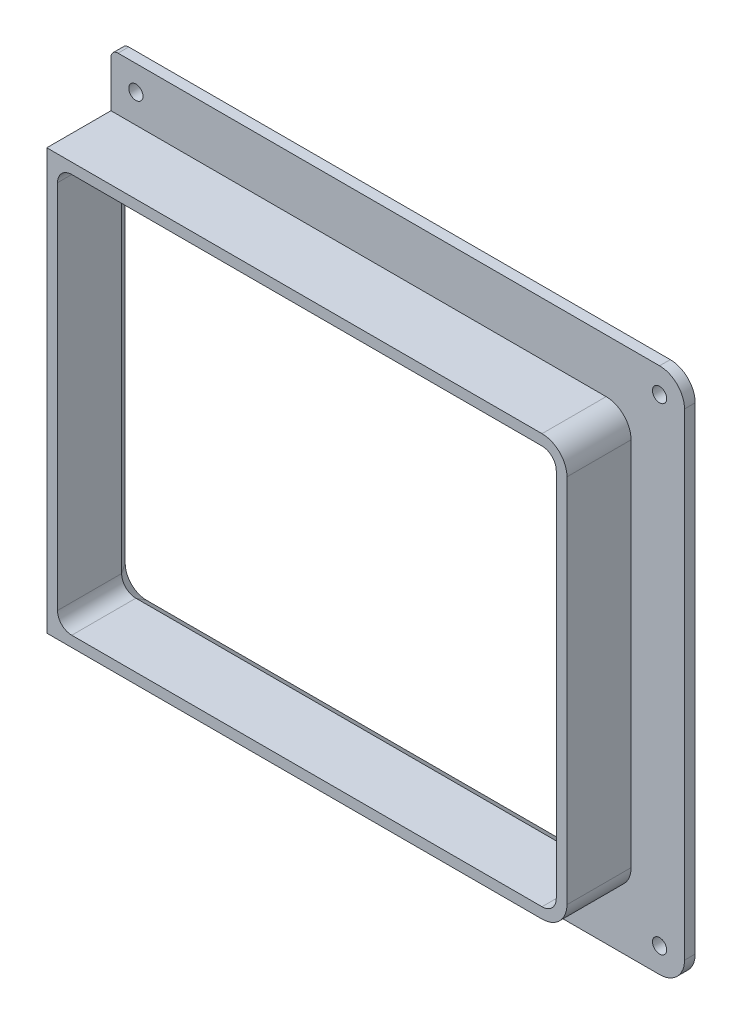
SolidWorks part; units mm, degrees
ref_plane "Спереди" through (0, 0, 0) normal (0, 0, 1) x (1, 0, 0)
ref_plane "Сверху" through (0, 0, 0) normal (0, 1, 0) x (1, 0, 0)
ref_plane "Справа" through (0, 0, 0) normal (1, 0, 0) x (0, 0, -1)
sketch "Эскиз1" plane through (0, 0, 0) normal (1, 0, 0) x (0, 0, -1)
  line L0 (0, 0) -> (0, 118) construction
  line L1 (0, 0) -> (-21, 0)
  line L2 (0, 0) -> (0, 3)
  line L3 (0, 3) -> (-21, 3)
  line L4 (-21, 0) -> (-21, 3)
  line L5 (0, 115) -> (-21, 115)
  line L6 (0, 115) -> (0, 118)
  line L7 (0, 118) -> (-21, 118)
  line L8 (-21, 115) -> (-21, 118)
  line L9 (0, 7) -> (-15, 13.9946)
  line L10 (-15, 13.9946) -> (-15, 16.9946)
  line L11 (-15, 16.9946) -> (0, 10)
  line L12 (0, 10) -> (0, 7)
  line L13 (-15, 27.2803) -> (-15, 30.2803)
  line L14 (-15, 30.2803) -> (0, 23.2857)
  line L15 (0, 23.2857) -> (0, 20.2857)
  line L16 (0, 20.2857) -> (-15, 27.2803)
  line L17 (-15, 40.566) -> (-15, 43.566)
  line L18 (-15, 43.566) -> (0, 36.5714)
  line L19 (0, 36.5714) -> (0, 33.5714)
  line L20 (0, 33.5714) -> (-15, 40.566)
  line L21 (-15, 53.8518) -> (-15, 56.8518)
  line L22 (-15, 56.8518) -> (0, 49.8571)
  line L23 (0, 49.8571) -> (0, 46.8571)
  line L24 (0, 46.8571) -> (-15, 53.8518)
  line L25 (-15, 67.1375) -> (-15, 70.1375)
  line L26 (-15, 70.1375) -> (0, 63.1429)
  line L27 (0, 63.1429) -> (0, 60.1429)
  line L28 (0, 60.1429) -> (-15, 67.1375)
  line L29 (-15, 80.4232) -> (-15, 83.4232)
  line L30 (-15, 83.4232) -> (0, 76.4286)
  line L31 (0, 76.4286) -> (0, 73.4286)
  line L32 (0, 73.4286) -> (-15, 80.4232)
  line L49 (-15, 93.7089) -> (-15, 96.7089)
  line L50 (-15, 96.7089) -> (0, 89.7143)
  line L51 (0, 89.7143) -> (0, 86.7143)
  line L52 (0, 86.7143) -> (-15, 93.7089)
  line L53 (-15, 106.9946) -> (-15, 109.9946)
  line L54 (-15, 109.9946) -> (0, 103)
  line L55 (0, 103) -> (0, 100)
  line L56 (0, 100) -> (-15, 106.9946)
  dimension "D2" = 118
  dimension "D3" = 3
  dimension "D4" = 21
  dimension "D5" = 4
  dimension "D6" = 12
  dimension "D7" = 15
  dimension "D8" = 65
  dimension "D9" = 3.2911
  dimension "D1" = 8
extrude "Бобышка-Вытянуть1" add sketch "Эскиз1" along normal blind 146
sketch "Эскиз2" plane through (0, 0, 0) normal (0, 0, -1) x (-1, 0, 0)
  line L0 (-146, 0) -> (0, 0) construction
  line L1 (-146, 118) -> (-143, 118)
  line L2 (-146, 118) -> (-146, 0)
  line L3 (-146, 0) -> (-143, 0)
  line L4 (-143, 118) -> (-143, 0)
  line L6 (0, 118) -> (-3, 118)
  line L7 (0, 118) -> (0, 0)
  line L8 (0, 0) -> (-3, 0)
  line L9 (-3, 118) -> (-3, 0)
  dimension "D1" = 3
  dimension "D2" = 3
extrude "Бобышка-Вытянуть2" add sketch "Эскиз2" against normal up to surface (21 mm away)
sketch "Эскиз3" plane through (0, 0, 0) normal (0, 0, -1) x (-1, 0, 0)
  line L0 (0, 59) -> (-146, 59) construction
  line L1 (-161, 0) -> (0, 0)
  line L2 (-161, 0) -> (-161, -15)
  line L3 (-161, -15) -> (0, -15)
  line L4 (0, 0) -> (0, -15)
  line L5 (0, 0) -> (0, 118) construction
  line L6 (-146, 0) -> (-146, 118) construction
  line L7 (-80.5, -15) -> (-80.5, 0) construction
  line L12 (0, 118) -> (0, 133)
  line L13 (-161, 133) -> (0, 133)
  line L14 (-161, 118) -> (-161, 133)
  line L15 (-161, 118) -> (0, 118)
  circle A2 centre (-154, -8) radius 2
  circle A3 centre (-7, -8) radius 2
  circle A6 centre (-7, 126) radius 2
  circle A7 centre (-154, 126) radius 2
extrude "Бобышка-Вытянуть3" add sketch "Эскиз3" against normal blind 3
sketch "Эскиз4" plane through (0, 0, 0) normal (0, 0, -1) x (-1, 0, 0)
  line L1 (-161, 118) -> (-146, 118)
  line L2 (-161, 118) -> (-161, 0)
  line L3 (-161, 0) -> (-146, 0)
  line L4 (-146, 118) -> (-146, 0)
extrude "Бобышка-Вытянуть4" add sketch "Эскиз4" against normal up to surface (3 mm away)
sketch "Эскиз5" plane through (0, 0, 0) normal (0, 0, -1) x (-1, 0, 0)
  line L1 (-143, 115) -> (-3, 115)
  line L2 (-143, 115) -> (-143, 3)
  line L3 (-143, 3) -> (-3, 3)
  line L4 (-3, 115) -> (-3, 3)
extrude "Вырез-Вытянуть1" cut sketch "Эскиз5" against normal through all
fillet "Скругление2" radius 4 4 edges at (3, 115, 10.5) (3, 3, 10.5) (143, 3, 10.5) (143, 115, 10.5)
fillet "Скругление3" radius 7 2 edges at (161, 133, 1.5) (161, -15, 1.5)
fillet "Скругление4" radius 7 2 edges at (146, 0, 12) (146, 118, 12)
fillet "Скругление5" radius 3 8 edges at (141.8284, 4.1716, 0) (73, 3, 0) (4.1716, 4.1716, 0) (4.1716, 113.8284, 0) (73, 115, 0) (141.8284, 113.8284, 0) (143, 59, 0) (3, 59, 0)
fillet "Скругление6" radius 2 2 edges at (0, -15, 1.5) (0, 133, 1.5)
equation "\"D4@Эскиз3\"=\"D3@Эскиз3\""
equation "\"D2@Эскиз3\"=\"D1@Эскиз3\""
